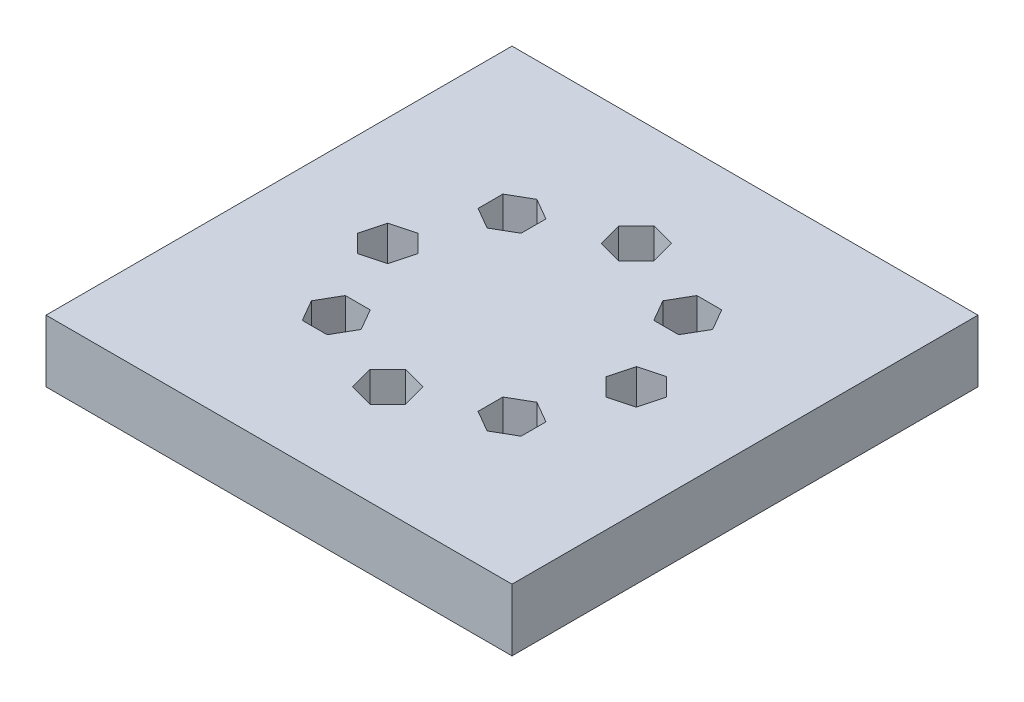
SolidWorks part; units mm, degrees
ref_plane "Front" through (0, 0, 0) normal (0, 0, 1) x (1, 0, 0)
ref_plane "Top" through (0, 0, 0) normal (0, 1, 0) x (1, 0, 0)
ref_plane "Right" through (0, 0, 0) normal (1, 0, 0) x (0, 0, -1)
sketch "Sketch2" plane through (0, 0, 0) normal (0, 1, 0) x (1, 0, 0)
  line L0 (75, -75) -> (-75, 75) construction
  line L1 (-75, 75) -> (75, 75)
  line L2 (-75, 75) -> (-75, -75)
  line L3 (-75, -75) -> (75, -75)
  line L4 (75, 75) -> (75, -75)
  dimension "D1" = 150
  dimension "D2" = 150
extrude "Extrude1" add sketch "Sketch2" along normal blind 20
sketch "Sketch3" plane through (0, 20, 0) normal (0, 1, 0) x (1, 0, 0)
  line L0 (0, 0) -> (67.7087, 0) construction
  line L1 (36.2843, 28.2843) -> (32.2843, 35.2125)
  line L2 (32.2843, 35.2125) -> (24.2843, 35.2125)
  line L3 (24.2843, 35.2125) -> (20.2843, 28.2843)
  line L4 (20.2843, 28.2843) -> (24.2843, 21.3561)
  line L5 (24.2843, 21.3561) -> (32.2843, 21.3561)
  line L6 (32.2843, 21.3561) -> (36.2843, 28.2843)
  line L7 (0, 0) -> (28.2843, 28.2843) construction
  circle A0 centre (28.2843, 28.2843) radius 6.9282 construction
  dimension "D2" = 8
  dimension "D1" = 40
  dimension "D3" = 45
extrude "Cut-Extrude1" cut sketch "Sketch3" against normal through all
pattern_circular "CirPattern1" count 8 over 360 about axis through (0, 0, 0) along (0, 1, 0) of "Cut-Extrude1"
